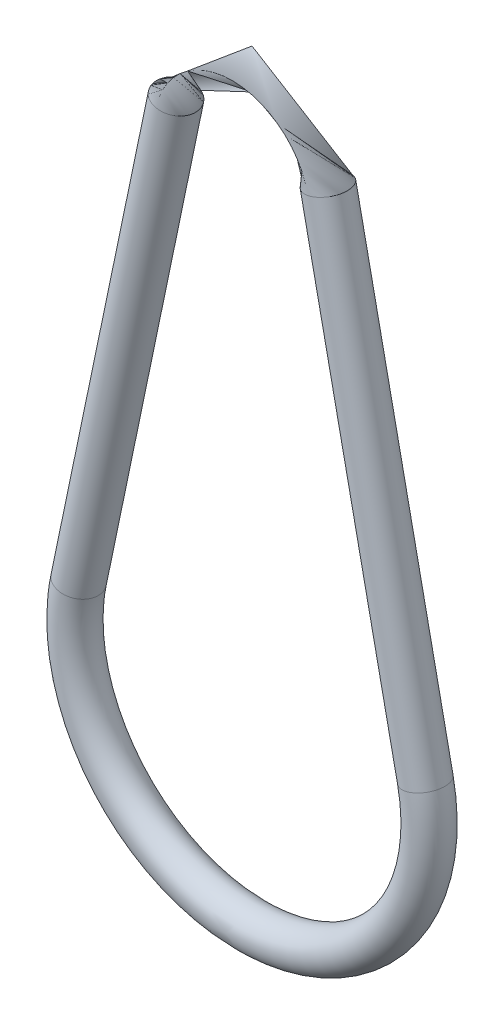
SolidWorks part; units mm, degrees
ref_plane "Front" through (0, 0, 0) normal (0, 0, 1) x (1, 0, 0)
ref_plane "Top" through (0, 0, 0) normal (0, 1, 0) x (1, 0, 0)
ref_plane "Right" through (0, 0, 0) normal (1, 0, 0) x (0, 0, -1)
sketch "Sketch1" plane through (0, 0, 0) normal (0, 0, 1) x (1, 0, 0)
  line L0 (0, 0) -> (0, 24.5) construction
  line L1 (-3.8179, 25.2959) -> (-8.7127, 1.8163)
  line L2 (3.8179, 25.2959) -> (8.7127, 1.8163)
  line L3 (-8.9, 0) -> (8.9, 0) construction
  arc A0 (3.8179, 25.2959) -> (-3.8179, 25.2959) centre (0, 24.5) ccw
  arc A1 (-8.7127, 1.8163) -> (8.7127, 1.8163) centre (0, 0) ccw
  dimension "D2" = 3.9
  dimension "D3" = 8.9
  dimension "D1" = 24.5
sketch "Sketch3" plane through (0, 0, 0) normal (0, 1, 0) x (1, 0, 0)
  circle A0 centre (-8.9, 0) radius 1
sweep "Sweep1" add profiles "Sketch3" path "Sketch1"
sketch "Sketch4" plane through (0, 0, 0) normal (0, 1, 0) x (1, 0, 0)
  circle A0 centre (0, 0) radius 0.001
extrude "Cut-Extrude1" cut sketch "Sketch4" against normal mid plane 141
sketch "Sketch5" plane through (0, 0, 0) normal (0, 0, 1) x (1, 0, 0)
  point P0 (0, 24.5)
  point P1 (0, 0)
